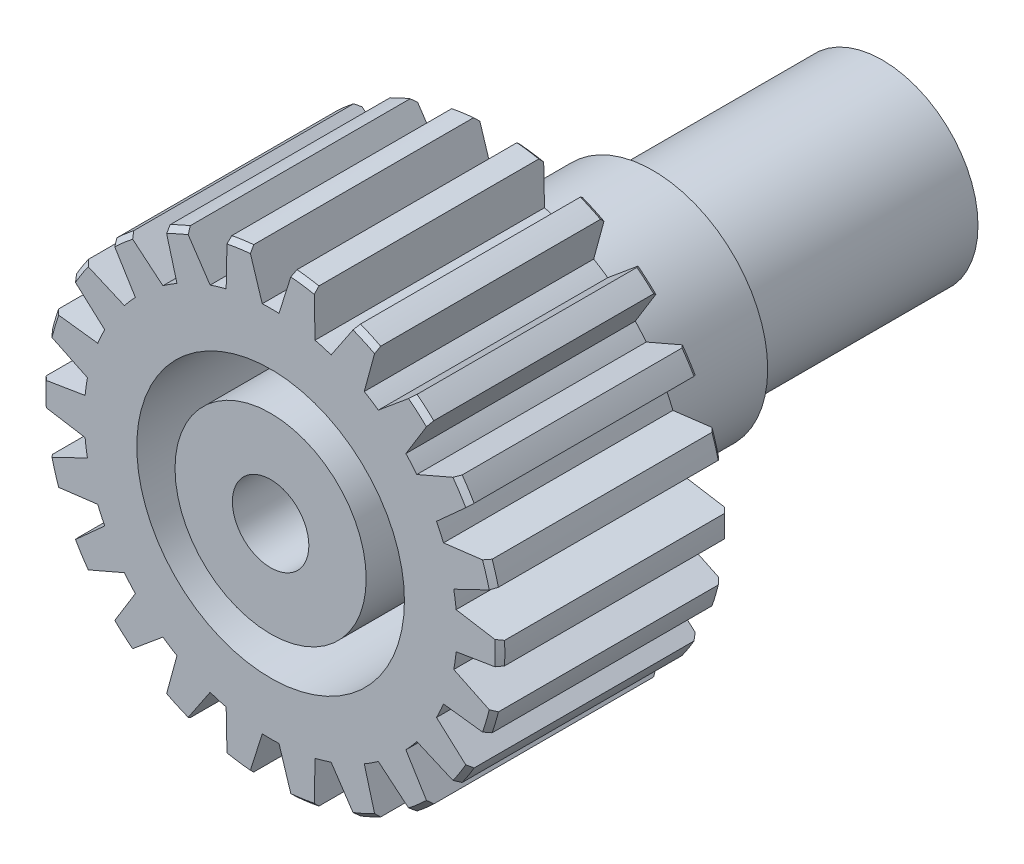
SolidWorks part; units mm, degrees
ref_plane "Plan1" through (0, 0, 0) normal (0, 0, 1) x (1, 0, 0)
ref_plane "Plan2" through (0, 0, 0) normal (0, 1, 0) x (1, 0, 0)
ref_plane "Plan3" through (0, 0, 0) normal (1, 0, 0) x (0, 0, -1)
sketch "Diamètre primitif" plane through (0, 0, 0) normal (0, 0, 1) x (1, 0, 0)
  line L0 (0, 0) -> (0.5, 0) construction
  circle A0 centre (0, 0) radius 5.5
  point P3 (0, 0)
  dimension "D1" = 11
  dimension "D2" = 0.5
sketch "Esquisse2" plane through (0, 0, 0) normal (0, 0, 1) x (1, 0, 0)
  circle A0 centre (0, 0) radius 6
  dimension "D1" = 12
extrude "Diamètre de tête" add sketch "Esquisse2" along normal mid plane 6
chamfer "Chanfreins" distance 0.125 angle 45
sketch "Esquisse3" plane through (0, 0, 0) normal (0, 0, 1) x (1, 0, 0)
  line L0 (0, 0) -> (0, 6) construction
  line L1 (-0.2188, 4.8701) -> (-0.5666, 5.9732)
  line L2 (0.2188, 4.8701) -> (0.5666, 5.9732)
  arc A0 (0.2188, 4.8701) -> (-0.2188, 4.8701) centre (0, 0) ccw
  circle A1 centre (0, 0) radius 6 construction
  arc A2 (0.5666, 5.9732) -> (-0.5666, 5.9732) centre (0, 0) ccw
  point P1 (-0.3927, 5.4216)
  point P10 (0.3927, 5.4216)
  dimension "D1" = 9.75
  dimension "D2" = 0.7854
  dimension "D3" = 325
extrude "Creux dent" cut sketch "Esquisse3" against normal through all and the other way through all
pattern_circular "Répétition" count 22 over 360
sketch "Esquisse4" plane through (0, 0, 3) normal (0, 0, 1) x (1, 0, 0)
  circle A0 centre (0, 0) radius 1
  dimension "D1" = 2
extrude "Enlèv. mat.-Extru.1" cut sketch "Esquisse4" against normal through all
sketch "Esquisse5" plane through (0, 0, -3) normal (0, 0, -1) x (-1, 0, 0)
  circle A0 centre (0, 0) radius 3
  dimension "D1" = 6
extrude "Extrusion1" add sketch "Esquisse5" along normal blind 4
sketch "Esquisse6" plane through (0, 0, -7) normal (0, 0, -1) x (-1, 0, 0)
  circle A0 centre (0, 0) radius 2.5
  dimension "D1" = 5
extrude "Extrusion2" add sketch "Esquisse6" along normal blind 6
sketch "Esquisse7" plane through (0, 0, -13) normal (0, 0, -1) x (-1, 0, 0)
  line L1 (1.7321, 0) -> (0.866, 1.5)
  line L2 (0.866, 1.5) -> (-0.866, 1.5)
  line L3 (-0.866, 1.5) -> (-1.7321, 0)
  line L4 (-1.7321, 0) -> (-0.866, -1.5)
  line L5 (-0.866, -1.5) -> (0.866, -1.5)
  line L6 (0.866, -1.5) -> (1.7321, 0)
  circle A0 centre (0, 0) radius 1.5 construction
  dimension "D1" = 3
extrude "Enlèv. mat.-Extru.2" cut sketch "Esquisse7" against normal blind 8
sketch "Esquisse8" plane through (0, 0, 3) normal (0, 0, 1) x (1, 0, 0)
  circle A0 centre (0, 0) radius 3
  dimension "D1" = 6
extrude "Enlèv. de mat.-Extru.-Mince1" cut sketch "Esquisse8" against normal blind 5 thin
equation "\"D1@Esquisse2\" = \"D1@Diamètre primitif\" + 2 * \"D2@Diamètre primitif\""
equation "\"D1@Chanfreins\" = 0.25*\"D2@Diamètre primitif\""
equation "\"D1@Esquisse3\" = \"D1@Diamètre primitif\"-2.5*\"D2@Diamètre primitif\""
equation "\"D2@Esquisse3\"=3.14159*\"D2@Diamètre primitif\"/2"
equation "\"D1@Répétition\" = \"D1@Diamètre primitif\"/\"D2@Diamètre primitif\""
